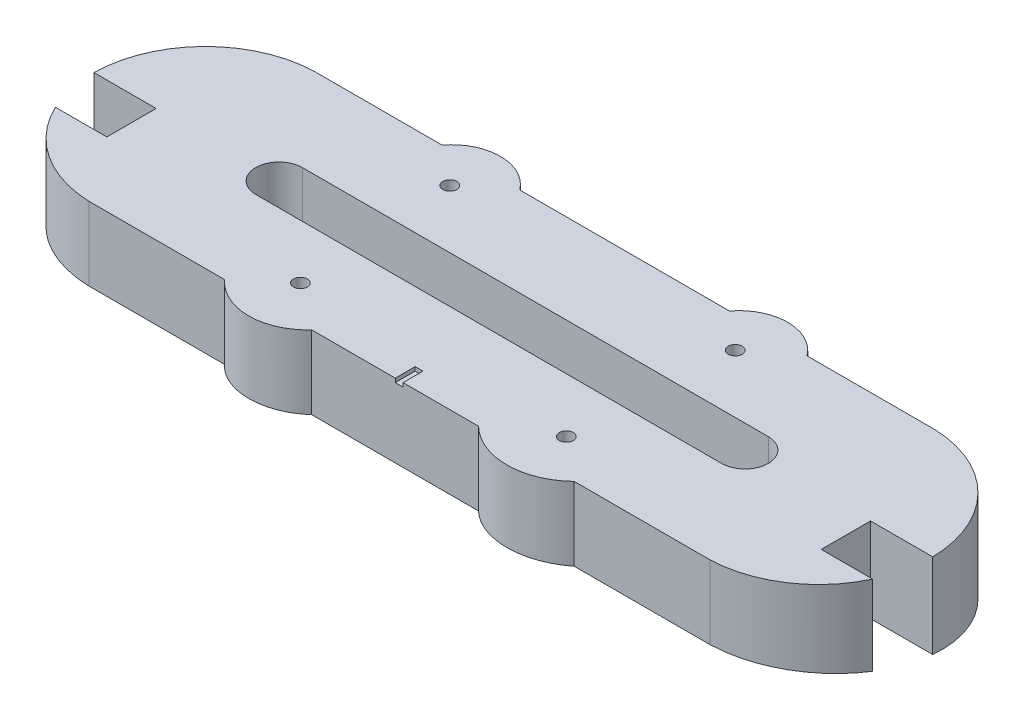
SolidWorks part; units mm, degrees
ref_plane "Front Plane" through (0, 0, 0) normal (0, 0, 1) x (1, 0, 0)
ref_plane "Top Plane" through (0, 0, 0) normal (0, 1, 0) x (1, 0, 0)
ref_plane "Right Plane" through (0, 0, 0) normal (1, 0, 0) x (0, 0, -1)
sketch "Sketch2" plane through (0, 0, 0) normal (0, 1, 0) x (1, 0, 0)
  line L1 (-101.2397, 38.7481) -> (114.7603, 38.7481)
  line L2 (-101.2397, 38.7481) -> (-101.2397, -29.2519)
  line L3 (-101.2397, -29.2519) -> (114.7603, -29.2519)
  line L4 (114.7603, 38.7481) -> (114.7603, -29.2519)
  dimension "D1" = 216
  dimension "D2" = 68
extrude "Boss-Extrude1" add sketch "Sketch2" along normal blind 12
sketch "Sketch3" plane through (0, 12, 0) normal (0, 1, 0) x (1, 0, 0)
  line L3 (-101.2397, -29.2519) -> (114.7603, -29.2519) construction
  line L4 (6.7603, 38.7481) -> (6.7603, -29.2519) construction
  line L5 (114.7603, 38.7481) -> (-101.2397, 38.7481) construction
  line L6 (-53.2397, 4.7481) -> (66.7603, 4.7481) construction
  line L7 (-53.2397, 10.7481) -> (66.7603, 10.7481)
  line L8 (-53.2397, -1.2519) -> (66.7603, -1.2519)
  arc A2 (-53.2397, 10.7481) -> (-53.2397, -1.2519) centre (-53.2397, 4.7481) ccw
  arc A3 (66.7603, -1.2519) -> (66.7603, 10.7481) centre (66.7603, 4.7481) ccw
  point P16 (6.7603, 4.7481)
  dimension "D1" = 12
  dimension "D4" = 120
  dimension "30" = 34
extrude "Cut-Extrude1" cut sketch "Sketch3" against normal through all
sketch "Sketch4" plane through (0, 12, 0) normal (0, 1, 0) x (1, 0, 0)
  line L0 (130.7603, -1.2519) -> (98.7603, -1.2519) construction
  line L1 (114.7603, -29.2519) -> (114.7603, 38.7481) construction
  line L2 (130.7603, -7.6019) -> (98.7603, -7.6019)
  line L3 (130.7603, 5.0981) -> (98.7603, 5.0981)
  line L4 (6.7603, 38.7481) -> (6.7603, -29.2519) construction
  line L5 (114.7603, 38.7481) -> (-101.2397, 38.7481) construction
  line L6 (-101.2397, -29.2519) -> (114.7603, -29.2519) construction
  line L7 (-117.2397, -1.2519) -> (-85.2397, -1.2519) construction
  line L8 (-117.2397, -7.6019) -> (-85.2397, -7.6019)
  line L9 (-117.2397, 5.0981) -> (-85.2397, 5.0981)
  line L10 (98.7603, 5.0981) -> (98.7603, -7.6019)
  line L11 (-85.2397, 5.0981) -> (-85.2397, -7.6019)
  arc A0 (130.7603, -7.6019) -> (130.7603, 5.0981) centre (130.7603, -1.2519) ccw
  arc A2 (-117.2397, -7.6019) -> (-117.2397, 5.0981) centre (-117.2397, -1.2519) cw
  point P4 (114.7603, -1.2519)
  point P18 (-101.2397, -1.2519)
  dimension "D1" = 16
  dimension "D2" = 12.7
  dimension "D3" = 28
  dimension "D4" = 12.7
  dimension "D5" = 28
extrude "Cut-Extrude2" cut sketch "Sketch4" against normal blind 12
sketch "Sketch6" plane through (0, 12, 0) normal (0, 1, 0) x (1, 0, 0)
  line L0 (-40.2397, 33.7481) -> (-73.2397, 33.7481)
  line L1 (86.7603, -24.2519) -> (51.7603, -24.2519)
  line L2 (-73.2397, -24.2519) -> (-38.2397, -24.2519)
  line L3 (86.7603, 33.7481) -> (86.7603, -88.2381) construction
  line L4 (114.7603, 38.7481) -> (-101.2397, 38.7481) construction
  line L5 (-101.2397, -29.2519) -> (114.7603, -29.2519) construction
  line L6 (53.7603, 33.7481) -> (86.7603, 33.7481)
  line L7 (33.7603, 33.7481) -> (-20.2397, 33.7481)
  line L8 (114.7603, 5.0981) -> (114.7603, 38.7481) construction
  line L9 (-30.2397, 36.2481) -> (145.8332, 36.2481) construction
  line L10 (-73.2397, 38.7481) -> (-73.2397, -29.2519) construction
  line L11 (-15.8626, -24.2519) -> (27.1374, -24.2519)
  line L12 (6.7603, 38.7481) -> (6.7603, -29.2519) construction
  line L13 (43.7603, 26.2481) -> (43.7603, -53.3999) construction
  arc A0 (-40.2397, 33.7481) -> (-20.2397, 33.7481) centre (-30.2397, 26.2481) cw
  circle A1 centre (40.7603, -15.7519) radius 10
  arc A2 (86.7603, 33.7481) -> (86.7603, -24.2519) centre (85.7424, 4.7481) cw
  circle A3 centre (-30.2397, 26.2481) radius 10
  arc A4 (53.7603, 33.7481) -> (33.7603, 33.7481) centre (43.7603, 26.2481) ccw
  circle A5 centre (43.7603, 26.2481) radius 10
  circle A6 centre (-27.2397, -15.7519) radius 10
  arc A7 (51.7603, -24.2519) -> (27.1374, -24.2519) centre (39.4489, -11.5948) cw
  arc A8 (-38.2397, -24.2519) -> (-15.8626, -24.2519) centre (-27.0511, -14.2335) ccw
  arc A9 (-73.2397, 33.7481) -> (-73.2397, -24.2519) centre (-72.2218, 4.7481) ccw
  dimension "D1" = 28
  dimension "D2" = 5
  dimension "D6" = 20
  dimension "D7" = 20
  dimension "D10" = 37
  dimension "D13" = 5
  dimension "D5" = 43
  dimension "D15" = 33
  dimension "D16" = 20
  dimension "D18" = 35
  dimension "D3" = 5
  dimension "D4" = 20
  dimension "D8" = 28
  dimension "D9" = 5
  dimension "D11" = 37
  dimension "D12" = 42
  dimension "D17" = 35
extrude "Cut-Extrude3" cut sketch "Sketch6" against normal blind 12 contours A9 L0 A0 M5 M6 | A9 A8 L2 M6 M7 | A8 A7 L11 M7 | L1 A7 A2 M7 M8 M1 | A4 L6 A2 M3 M4 M5 | A4 A0 L7 M5
sketch "Sketch7" plane through (0, 12, 0) normal (0, 1, 0) x (1, 0, 0)
  line L0 (-30.2397, 38.7481) -> (-30.2397, -62.374) construction
  line L1 (-30.2397, 25.7481) -> (84.6371, 25.7481) construction
  line L2 (6.7603, 33.7481) -> (5.6374, -24.2519) construction
  line L3 (33.7603, 33.7481) -> (-20.2397, 33.7481) construction
  line L4 (-15.8626, -24.2519) -> (27.1374, -24.2519) construction
  line L5 (43.2603, 25.7481) -> (43.2603, -53.7675) construction
  circle A0 centre (-27.7397, -15.2519) radius 1.8
  circle A1 centre (40.7603, -15.2519) radius 1.8
  circle A2 centre (43.2603, 25.7481) radius 1.8
  circle A3 centre (-30.2397, 25.7481) radius 1.8
  arc A4 (-20.2397, 33.7481) -> (-40.2397, 33.7481) centre (-30.2397, 26.2481) ccw construction
  point P8 (-30.2397, 38.7481)
  dimension "D1" = 3.6
  dimension "D2" = 3.6
  dimension "D3" = 3.6
  dimension "D4" = 3.6
  dimension "D5" = 13
  dimension "D7" = 41
  dimension "D6" = 36.5
  dimension "D8" = 41
  dimension "D9" = 2.5
  dimension "D10" = 2.5
extrude "Cut-Extrude4" cut sketch "Sketch7" against normal blind 9
sketch "Sketch8" plane through (0, 12, 0) normal (0, 1, 0) x (1, 0, 0)
  line L0 (-15.8626, -24.2519) -> (27.1374, -24.2519) construction
  line L1 (5.7001, -19.1307) -> (7.7001, -19.1307)
  line L2 (5.7001, -19.1307) -> (5.7001, -24.2519)
  line L3 (5.7001, -24.2519) -> (7.7001, -24.2519)
  line L4 (7.7001, -19.1307) -> (7.7001, -24.2519)
  dimension "D1" = 2
extrude "Cut-Extrude5" cut sketch "Sketch8" against normal blind 1
sketch "Sketch9" [suppressed] plane through (0, 12, 0) normal (0, 1, 0) x (1, 0, 0)
  line L1 (-101.2376, 49.9813) -> (-82.2376, 49.9813)
  line L2 (-101.2376, 49.9813) -> (-101.2376, -55.9248)
  line L3 (-101.2376, -55.9248) -> (-82.2376, -55.9248)
  line L4 (-82.2376, 49.9813) -> (-82.2376, -55.9248)
  line L5 (114.7582, 49.9813) -> (95.7582, 49.9813)
  line L6 (114.7582, 49.9813) -> (114.7582, -63.6446)
  line L7 (114.7582, -63.6446) -> (95.7582, -63.6446)
  line L8 (95.7582, 49.9813) -> (95.7582, -63.6446)
  dimension "D1" = 19
  dimension "D2" = 19
extrude "Cut-Extrude6" [suppressed] cut sketch "Sketch9" against normal blind 12
sketch "Sketch10" [suppressed] plane through (0, 12, 0) normal (0, 1, 0) x (1, 0, 0)
  line L1 (-40.2397, 33.7481) -> (53.4788, 33.7481)
  line L2 (-40.2397, 33.7481) -> (-40.2397, 53.7528)
  line L3 (-40.2397, 53.7528) -> (53.4788, 53.7528)
  line L4 (53.4788, 33.7481) -> (53.4788, 53.7528)
  line L5 (51.7603, -24.2519) -> (-52.6815, -24.2519)
  line L6 (51.7603, -24.2519) -> (51.7603, -42.6662)
  line L7 (51.7603, -42.6662) -> (-52.6815, -42.6662)
  line L8 (-52.6815, -24.2519) -> (-52.6815, -42.6662)
extrude "Cut-Extrude7" [suppressed] cut sketch "Sketch10" against normal blind 12
sketch "Sketch11" [suppressed] plane through (53.4788, 0, 0) normal (-1, 0, 0) x (0, 0, 1)
  line L4 (-34.1095, 12) -> (-34.1095, 0)
  line L5 (-34.1095, 0) -> (-33.7481, 0)
  line L6 (-33.7481, 0) -> (-33.7481, 12)
  line L7 (-33.7481, 12) -> (-34.1095, 12)
  line L8 (-34.1095, 12) -> (-34.1095, 0)
  line L9 (-34.1095, 0) -> (-33.7481, 0)
  line L10 (-33.7481, 0) -> (-33.7481, 12)
  line L11 (-33.7481, 12) -> (-34.1095, 12)
  dimension "D1" = 0
extrude "Cut-Extrude8" [suppressed] cut sketch "Sketch11" against normal blind 5
sketch "Sketch12" plane through (0, 0, 0) normal (0, -1, 0) x (1, 0, 0)
  line L0 (-53.2397, 1.2519) -> (66.7603, 1.2519) construction
  line L1 (66.7603, -10.7481) -> (-53.2397, -10.7481) construction
  line L2 (66.7603, -10.7481) -> (-53.2397, -10.7481)
  line L3 (-53.2397, 1.2519) -> (66.7603, 1.2519)
  line L12 (-73.2397, -33.7481) -> (-40.2397, -33.7481)
  line L13 (-20.2397, -33.7481) -> (33.7603, -33.7481)
  line L14 (53.7603, -33.7481) -> (86.7603, -33.7481)
  line L15 (114.7582, -5.0981) -> (98.7603, -5.0981)
  line L16 (98.7603, -5.0981) -> (98.7603, 7.6019)
  line L17 (98.7603, 7.6019) -> (112.001, 7.6019)
  line L18 (86.7603, 24.2519) -> (51.7603, 24.2519)
  line L19 (27.1374, 24.2519) -> (-15.8626, 24.2519)
  line L20 (-38.2397, 24.2519) -> (-73.2397, 24.2519)
  line L21 (-98.4804, 7.6019) -> (-85.2397, 7.6019)
  line L22 (-85.2397, 7.6019) -> (-85.2397, -5.0981)
  line L23 (-85.2397, -5.0981) -> (-101.2376, -5.0981)
  line L24 (-73.2397, -33.7481) -> (-40.2397, -33.7481)
  line L25 (-20.2397, -33.7481) -> (33.7603, -33.7481)
  line L26 (53.7603, -33.7481) -> (86.7603, -33.7481)
  line L27 (114.7582, -5.0981) -> (98.7603, -5.0981)
  line L28 (98.7603, -5.0981) -> (98.7603, 7.6019)
  line L29 (98.7603, 7.6019) -> (112.001, 7.6019)
  line L30 (86.7603, 24.2519) -> (51.7603, 24.2519)
  line L31 (27.1374, 24.2519) -> (-15.8626, 24.2519)
  line L32 (-38.2397, 24.2519) -> (-73.2397, 24.2519)
  line L33 (-98.4804, 7.6019) -> (-85.2397, 7.6019)
  line L34 (-85.2397, 7.6019) -> (-85.2397, -5.0981)
  line L35 (-85.2397, -5.0981) -> (-101.2376, -5.0981)
  arc A0 (-53.2397, 1.2519) -> (-53.2397, -10.7481) centre (-53.2397, -4.7481) ccw construction
  arc A1 (66.7603, -10.7481) -> (66.7603, 1.2519) centre (66.7603, -4.7481) ccw construction
  arc A2 (66.7603, -10.7481) -> (66.7603, 1.2519) centre (66.7603, -4.7481) ccw
  arc A3 (-53.2397, 1.2519) -> (-53.2397, -10.7481) centre (-53.2397, -4.7481) ccw
  arc A8 (-101.2376, -5.0981) -> (-73.2397, -33.7481) centre (-72.2218, -4.7481) ccw
  arc A9 (-40.2397, -33.7481) -> (-20.2397, -33.7481) centre (-30.2397, -26.2481) ccw
  arc A10 (33.7603, -33.7481) -> (53.7603, -33.7481) centre (43.7603, -26.2481) ccw
  arc A11 (86.7603, -33.7481) -> (114.7582, -5.0981) centre (85.7424, -4.7481) ccw
  arc A12 (112.001, 7.6019) -> (86.7603, 24.2519) centre (85.7424, -4.7481) ccw
  arc A13 (51.7603, 24.2519) -> (27.1374, 24.2519) centre (39.4489, 11.5948) ccw
  arc A14 (-15.8626, 24.2519) -> (-38.2397, 24.2519) centre (-27.0511, 14.2335) ccw
  arc A15 (-73.2397, 24.2519) -> (-98.4804, 7.6019) centre (-72.2218, -4.7481) ccw
  arc A16 (-101.2376, -5.0981) -> (-73.2397, -33.7481) centre (-72.2218, -4.7481) ccw
  arc A17 (-40.2397, -33.7481) -> (-20.2397, -33.7481) centre (-30.2397, -26.2481) ccw
  arc A18 (33.7603, -33.7481) -> (53.7603, -33.7481) centre (43.7603, -26.2481) ccw
  arc A19 (86.7603, -33.7481) -> (114.7582, -5.0981) centre (85.7424, -4.7481) ccw
  arc A20 (112.001, 7.6019) -> (86.7603, 24.2519) centre (85.7424, -4.7481) ccw
  arc A21 (51.7603, 24.2519) -> (27.1374, 24.2519) centre (39.4489, 11.5948) ccw
  arc A22 (-15.8626, 24.2519) -> (-38.2397, 24.2519) centre (-27.0511, 14.2335) ccw
  arc A23 (-73.2397, 24.2519) -> (-98.4804, 7.6019) centre (-72.2218, -4.7481) ccw
  dimension "D1" = 0
extrude "Boss-Extrude2" add sketch "Sketch12" along normal blind 20
sketch "Sketch14" plane through (0, 0, 0) normal (1, 0, 0) x (0, 0, -1)
  line L0 (38.7481, -13.119) -> (-29.2519, -6.4276)
  line L1 (38.7481, -20) -> (38.7481, 12) construction
  line L2 (-29.2519, 12) -> (-29.2519, -20) construction
  line L3 (-29.2519, -6.4276) -> (-29.2519, -20)
  line L4 (-29.2519, -20) -> (-24.2519, -20) construction
  line L5 (-29.2519, -20) -> (38.7481, -20)
  line L6 (38.7481, -20) -> (38.7481, -13.119)
  line L7 (-24.2519, 12) -> (-29.2519, 12) construction
  dimension "D1" = 5.62
  dimension "D2" = 18.4276
extrude "Cut-Extrude9" cut sketch "Sketch14" against normal through all both and the other way through all
sketch "Sketch15" [suppressed] plane through (0, 0, 0) normal (1, 0, 0) x (0, 0, -1)
  line L0 (-29.2519, -20) -> (-29.2519, 0)
  line L1 (-29.2519, 12) -> (-29.2519, -20) construction
  line L2 (-29.2519, 0) -> (38.7481, -13.489)
  line L4 (38.7481, -20) -> (38.7481, 12) construction
  line L5 (-29.2519, -20) -> (38.7481, -20)
  line L6 (38.7481, -20) -> (38.7481, -13.489)
  dimension "D1" = 6.58
  dimension "D2" = 10
extrude "Cut-Extrude10" [suppressed] cut sketch "Sketch15" against normal through all both and the other way through all
